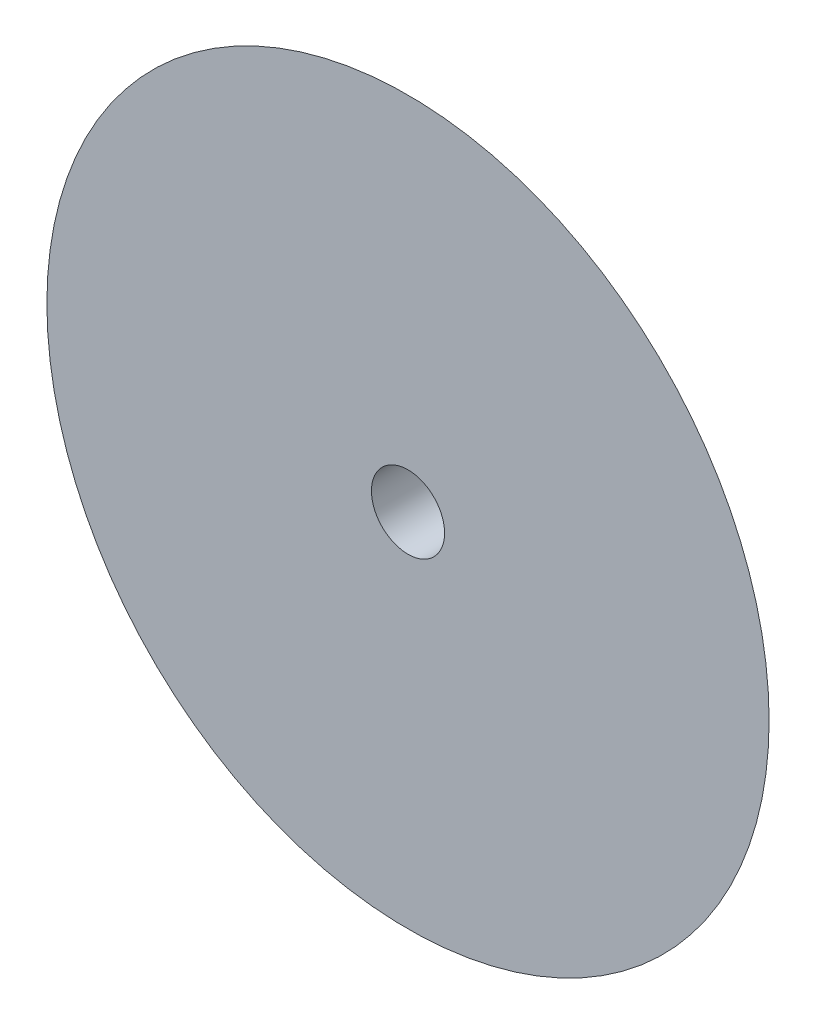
SolidWorks part; units mm, degrees
ref_plane "Front" through (0, 0, 0) normal (0, 0, 1) x (1, 0, 0)
ref_plane "Top" through (0, 0, 0) normal (0, 1, 0) x (1, 0, 0)
ref_plane "Right" through (0, 0, 0) normal (1, 0, 0) x (0, 0, -1)
sketch "Sketch1" plane through (0, 0, 0) normal (1, 0, 0) x (0, 0, -1)
  line L0 (0, 38.7212) -> (0, -43.2766) construction
  line L1 (-44.0359, 0) -> (72.2796, 0) construction
  line L2 (0, 2.413) -> (0, 23.8125)
  line L3 (0, 2.413) -> (7.62, 2.413)
  arc A0 (0, 23.8125) -> (7.62, 2.413) centre (-36.6744, -1.3031) cw
  dimension "D4" = 44.45
  dimension "D1" = 4.826
  dimension "D2" = 7.62
  dimension "D3" = 47.625
revolve "Revolve1" add sketch "Sketch1" angle 360 about L1
ref_plane "Plane1" through (0, 0, -12.7) normal (0, 0, 1) x (1, 0, 0)
sketch "Sketch2" plane through (0, 0, -12.7) normal (0, 0, 1) x (1, 0, 0)
  circle A0 centre (0, 0) radius 4.7625
  dimension "D1" = 9.525
extrude "Cut-Extrude1" cut sketch "Sketch2" along normal blind 8.89
